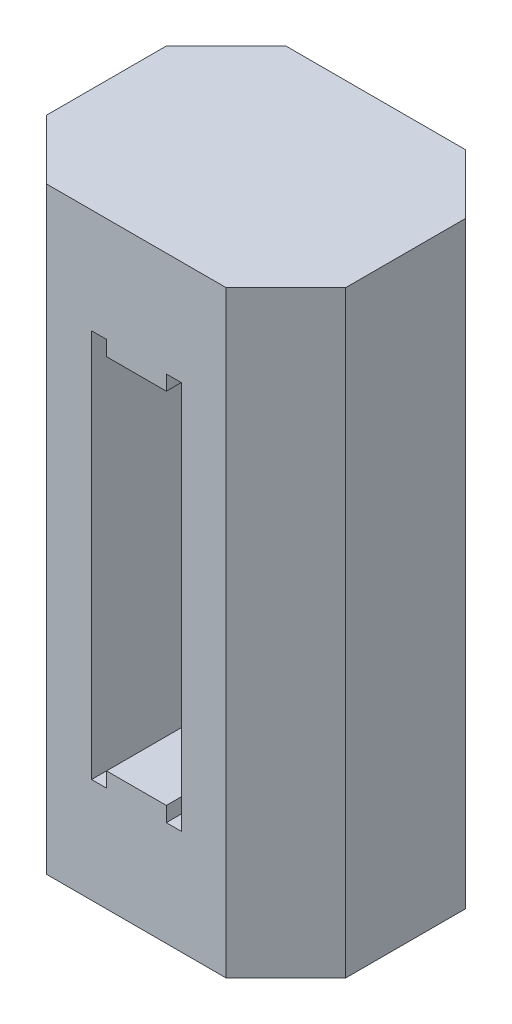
SolidWorks part; units mm, degrees
ref_plane "Plan1" through (0, 0, 0) normal (0, 0, 1) x (1, 0, 0)
ref_plane "Plan2" through (0, 0, 0) normal (0, 1, 0) x (1, 0, 0)
ref_plane "Plan3" through (0, 0, 0) normal (1, 0, 0) x (0, 0, -1)
sketch "Esquisse1" plane through (0, 0, 0) normal (0, 0, 1) x (1, 0, 0)
  line L1 (0, 0) -> (10, 0)
  line L2 (0, 0) -> (0, 20)
  line L3 (0, 20) -> (10, 20)
  line L4 (10, 0) -> (10, 20)
  dimension "D1" = 10
  dimension "D2" = 20
extrude "Base-Extrusion" add sketch "Esquisse1" along normal blind 8
sketch "Esquisse2" plane through (0, 0, 8) normal (0, 0, 1) x (1, 0, 0)
  line L1 (3.5, 16.5) -> (4, 16.5)
  line L2 (3.5, 16.5) -> (3.5, 3.5)
  line L3 (3.5, 3.5) -> (4, 3.5)
  line L4 (6.5, 16.5) -> (6.5, 3.5)
  line L8 (5, 16) -> (5, 20) construction
  line L9 (6, 3.5) -> (6.5, 3.5)
  line L10 (10, 20) -> (0, 20) construction
  line L11 (5, 4) -> (5, 0) construction
  line L12 (0, 0) -> (10, 0) construction
  line L13 (4, 16) -> (6, 16)
  line L14 (4, 4) -> (6, 4)
  line L15 (6, 16) -> (6, 16.5)
  line L16 (4, 16) -> (4, 16.5)
  line L17 (4, 4) -> (4, 3.5)
  line L18 (6, 4) -> (6, 3.5)
  line L19 (6, 16.5) -> (6.5, 16.5)
  dimension "D1" = 3
  dimension "D2" = 12
  dimension "D3" = 13
  dimension "D4" = 2
extrude "Enlèv. mat.-Extru.1" cut sketch "Esquisse2" against normal through all
chamfer "Chanfrein1" distance 2 angle 45
